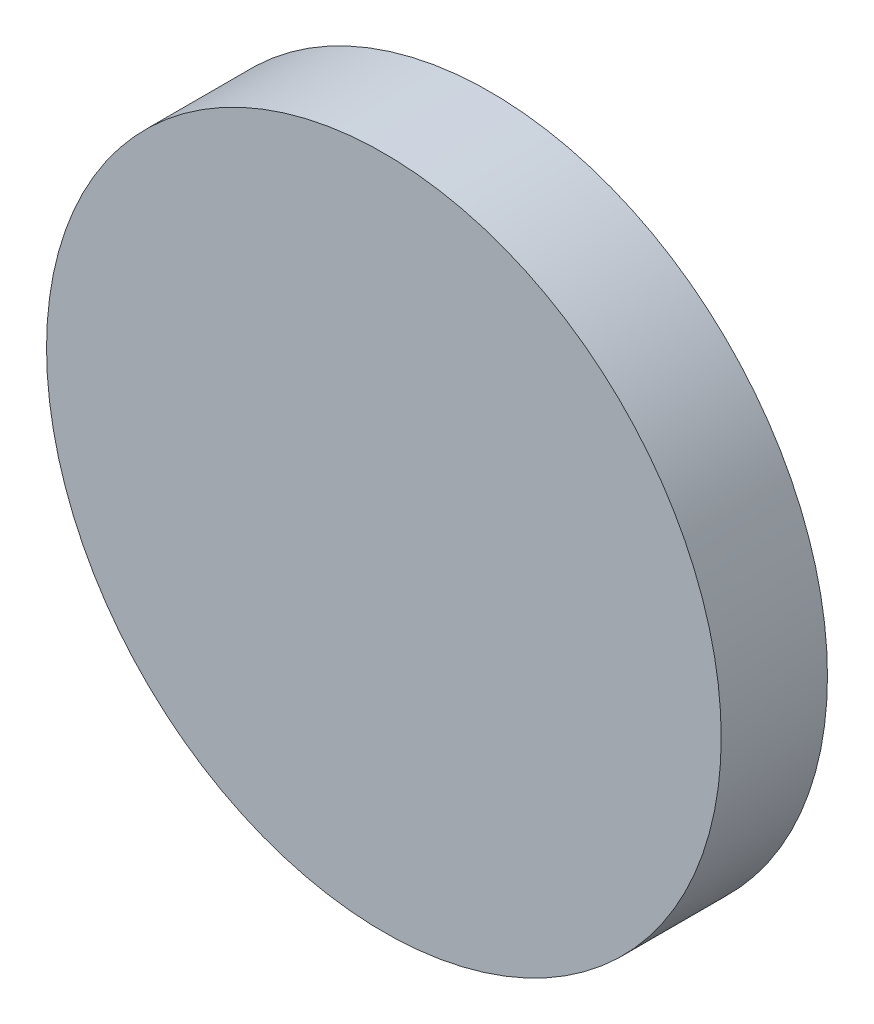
SolidWorks part; units mm, degrees
ref_plane "前视基准面" through (0, 0, 0) normal (0, 0, 1) x (1, 0, 0)
ref_plane "上视基准面" through (0, 0, 0) normal (0, 1, 0) x (1, 0, 0)
ref_plane "右视基准面" through (0, 0, 0) normal (1, 0, 0) x (0, 0, -1)
sketch "草图1" plane through (0, 0, 0) normal (0, 0, 1) x (1, 0, 0)
  circle A0 centre (0, 0) radius 12.7
  dimension "D1" = 25.4
extrude "凸台-拉伸1" add sketch "草图1" along normal blind 4
